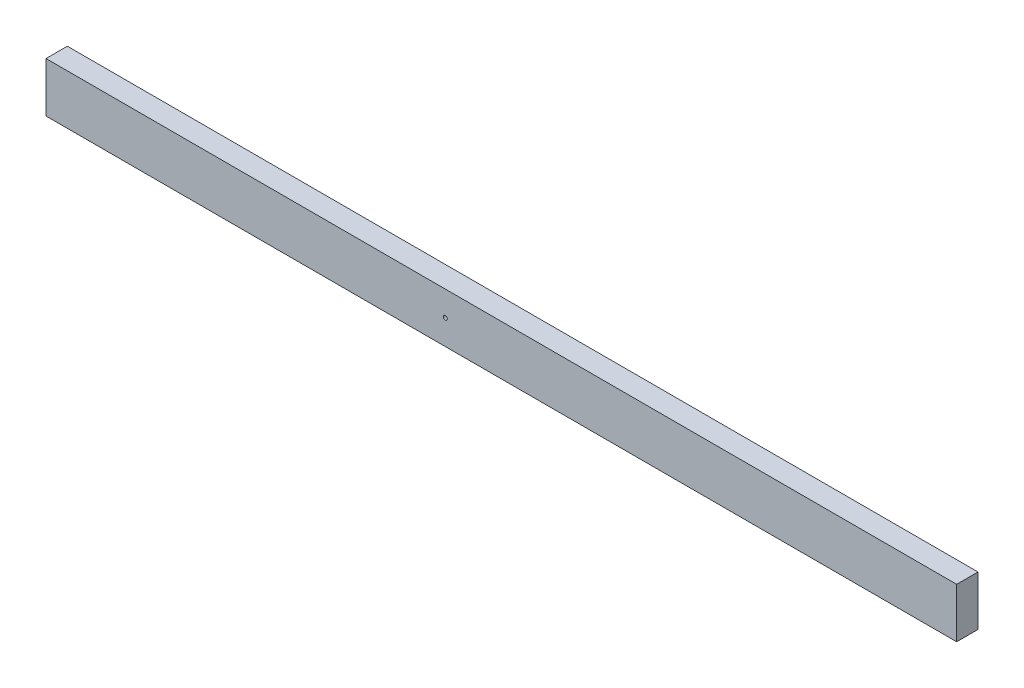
SolidWorks part; units mm, degrees
ref_plane "Front Plane" through (0, 0, 0) normal (0, 0, 1) x (1, 0, 0)
ref_plane "Top Plane" through (0, 0, 0) normal (0, 1, 0) x (1, 0, 0)
ref_plane "Right Plane" through (0, 0, 0) normal (1, 0, 0) x (0, 0, -1)
sketch "Sketch1" plane through (0, 0, 0) normal (1, 0, 0) x (0, 0, -1)
  line L1 (-19.05, -44.45) -> (19.05, -44.45)
  line L2 (-19.05, -44.45) -> (-19.05, 44.45)
  line L3 (-19.05, 44.45) -> (19.05, 44.45)
  line L4 (19.05, -44.45) -> (19.05, 44.45)
  line L5 (-19.05, -44.45) -> (19.05, 44.45) construction
  line L6 (-19.05, 44.45) -> (19.05, -44.45) construction
  point P0 (0, 0)
  dimension "D1" = 88.9
  dimension "D2" = 38.1
extrude "Boss-Extrude1" add sketch "Sketch1" along normal blind 1625.6
hole_wizard "9/32 (0.28125) Diameter Hole1" positions "Sketch3" profile "Sketch2" hole size "9/32" standard "ANSI Inch"
sketch "Sketch3" plane through (0, 0, 19.05) normal (0, 0, 1) x (1, 0, 0)
  line L1 (1625.6, -44.45) -> (0, -44.45) construction
  line L2 (1625.6, 44.45) -> (1625.6, -44.45) construction
  point P0 (712.7875, 0)
  dimension "D1" = 912.8125
  dimension "D2" = 44.45
sketch "Sketch2" plane through (712.7875, 0, 19.05) normal (1, 0, 0) x (0, -1, 0)
  line L0 (0, 0) -> (0, 38.1)
  line L1 (0, 38.1) -> (3.5719, 38.1)
  line L2 (3.5719, 38.1) -> (3.5719, 0)
  line L5 (3.5719, 0) -> (0, 0)
  line L11 (0, -6.35) -> (0, 107.95) construction
  dimension "Thru Hole Dia." = 7.1437
  dimension "Thru Hole Depth" = 38.1
